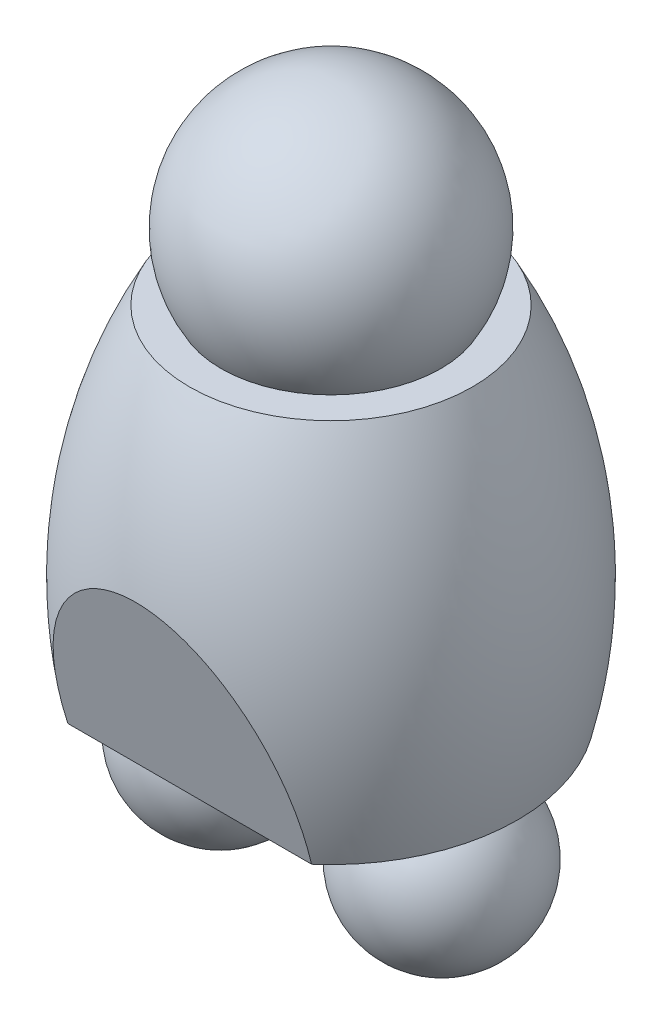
SolidWorks part; units mm, degrees
ref_plane "Front" through (0, 0, 0) normal (0, 0, 1) x (1, 0, 0)
ref_plane "Top" through (0, 0, 0) normal (0, 1, 0) x (1, 0, 0)
ref_plane "Right" through (0, 0, 0) normal (1, 0, 0) x (0, 0, -1)
sketch "Sketch1" plane through (0, 0, 0) normal (0, 0, 1) x (1, 0, 0)
  line L0 (0, 64.0999) -> (0, -73.9034) construction
  line L1 (0, 17.399) -> (0, -17.399)
  line L2 (0, 17.399) -> (13.97, 17.399)
  line L3 (0, -17.399) -> (18.415, -17.399)
  arc A0 (18.415, -17.399) -> (13.97, 17.399) centre (-28.4956, -5.7083) ccw
  point P5 (0, 0)
  dimension "D1" = 34.798
  dimension "D2" = 36.83
  dimension "D3" = 27.94
revolve "Base-Revolve" add sketch "Sketch1" angle 360 about L0
sketch "Sketch2" plane through (0, 0, 0) normal (1, 0, 0) x (0, 0, -1)
  line L2 (-13.944, -17.399) -> (-19.2864, 1.651)
  line L4 (-19.2864, 1.651) -> (-22.8418, 1.651)
  line L5 (-22.8418, 1.651) -> (-22.8418, -17.8942)
  line L7 (19.796, -3.429) -> (22.7378, -3.429)
  line L8 (-22.8418, -17.8942) -> (-13.944, -17.8942)
  line L9 (-13.944, -17.8942) -> (-13.944, -17.399)
  line L10 (22.7378, -3.429) -> (22.7378, -17.8942)
  line L11 (19.796, -3.429) -> (14.0946, -17.399)
  line L12 (22.7378, -17.8942) -> (14.0946, -17.8942)
  line L13 (14.0946, -17.8942) -> (14.0946, -17.399)
extrude "Cut-Extrude1" cut sketch "Sketch2" against normal mid plane 31.9537
sketch "Sketch3" plane through (0, 0, 0) normal (0, 0, 1) x (1, 0, 0)
  line L0 (0, 0) -> (0, 19.8525) construction
  line L1 (0, 64.0999) -> (0, -73.9034) construction
  line L2 (-12.0282, -17.399) -> (12.0282, -17.399) construction
  line L3 (0, 36.703) -> (0, 11.303)
  arc A0 (0, 11.303) -> (0, 36.703) centre (0, 24.003) ccw
  dimension "D1" = 25.4
  dimension "D2" = 41.402
revolve "Boss-Revolve1" add sketch "Sketch3" angle 360 about L0
sketch "Sketch5" plane through (0, 0, 0) normal (0, 0, 1) x (1, 0, 0)
  line L2 (13.97, 17.399) -> (-13.97, 17.399) construction
  line L3 (10.922, -36.2416) -> (10.922, -14.22) construction
  line L6 (10.922, -16.2306) -> (10.922, -32.7914)
  arc A0 (10.922, -32.7914) -> (10.922, -16.2306) centre (10.922, -24.511) ccw
  dimension "D1" = 16.5608
  dimension "D2" = 41.91
  dimension "D3" = 10.922
revolve "Boss-Revolve2" add sketch "Sketch5" angle 360 about L3
mirror "Mirror1" about plane through (0, 0, 0) normal (1, 0, 0)
scale "Escala1" scale about centroid uniform scaling yes scale factor 6
